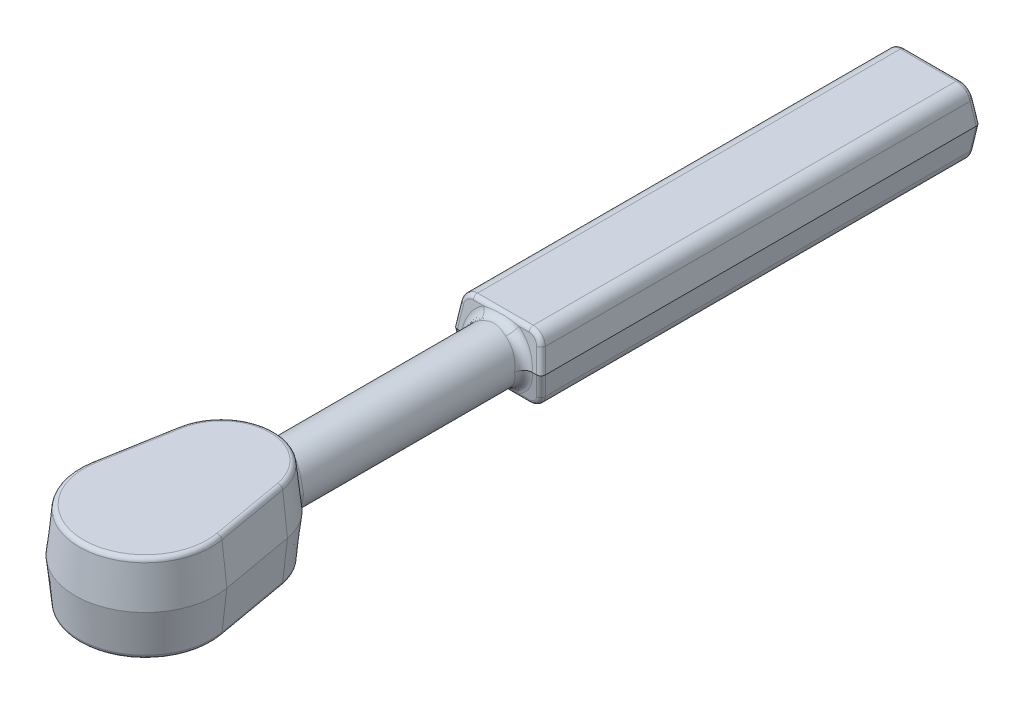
SolidWorks part; units mm, degrees
ref_plane "Front Plane" through (0, 0, 0) normal (0, 0, 1) x (1, 0, 0)
ref_plane "Top Plane" through (0, 0, 0) normal (0, 1, 0) x (1, 0, 0)
ref_plane "Right Plane" through (0, 0, 0) normal (1, 0, 0) x (0, 0, -1)
sketch "Sketch1" plane through (0, 0, 0) normal (0, 1, 0) x (1, 0, 0)
  line L0 (0, 0) -> (0, 180) construction
  line L1 (-10, 180) -> (10, 180)
  line L2 (10, 180) -> (10, 80)
  line L3 (-10, 180) -> (-10, 80)
  line L4 (10, 80) -> (0, 80)
  line L5 (-10, 80) -> (0, 80)
  dimension "D1" = 100
  dimension "D2" = 20
  dimension "D3" = 180
extrude "Handle" add sketch "Sketch1" along normal mid plane 15 draft 8
sketch "Sketch2" plane through (0, 0, 0) normal (0, 0, 1) x (1, 0, 0)
  circle A0 centre (0, 0) radius 6
  dimension "D1" = 12
extrude "Transition" add sketch "Sketch2" against normal up to next
sketch "Sketch3" plane through (0, 0, 0) normal (0, 1, 0) x (1, 0, 0)
  line L0 (0, 0) -> (0, 17.2763) construction
  line L1 (-12.8025, 19.5337) -> (-15.7569, 2.7784)
  line L2 (12.8025, 19.5337) -> (15.7569, 2.7784)
  arc A0 (15.7569, 2.7784) -> (-15.7569, 2.7784) centre (0, 0) cw
  arc A1 (-12.8025, 19.5337) -> (12.8025, 19.5337) centre (0, 17.2763) cw
  dimension "D1" = 13
  dimension "D2" = 16
  dimension "D4" = 20
extrude "Head" add sketch "Sketch3" along normal mid plane 20 draft 6
sketch "Sketch4" plane through (0, 10, 0) normal (0, 1, 0) x (-1, 0, 0)
  line L4 (9.7978, -19.0039) -> (12.7522, -2.2486)
  line L5 (-12.7522, -2.2486) -> (-9.7978, -19.0039)
  line L6 (9.7978, -19.0039) -> (12.7522, -2.2486)
  line L7 (-12.7522, -2.2486) -> (-9.7978, -19.0039)
  arc A4 (-9.7978, -19.0039) -> (9.7978, -19.0039) centre (0, -17.2763) ccw
  arc A5 (12.7522, -2.2486) -> (-12.7522, -2.2486) centre (0, 0) ccw
  arc A6 (-9.7978, -19.0039) -> (9.7978, -19.0039) centre (0, -17.2763) ccw
  arc A7 (12.7522, -2.2486) -> (-12.7522, -2.2486) centre (0, 0) ccw
  dimension "D1" = 2
extrude "Recess" [suppressed] cut sketch "Sketch4" against normal blind 2
sketch "Sketch5" [suppressed] plane through (0, 8, 0) normal (0, 1, 0) x (-1, 0, 0)
  arc A0 (-5.8786, -10.4615) -> (5.8786, -10.4615) centre (0, -17.2763) ccw
  arc A1 (5.8786, -10.4615) -> (-5.8786, -10.4615) centre (0, 0) ccw
  arc A2 (12.7522, -2.2486) -> (-12.7522, -2.2486) centre (0, 0) ccw construction
  dimension "D1" = 18
  dimension "D2" = 24
extrude "Pocket" [suppressed] cut sketch "Sketch5" against normal offset from surface (13 mm away) 5
sketch "Sketch6" [suppressed] plane through (0, -5, 0) normal (0, 1, 0) x (-1, 0, 0)
  circle A0 centre (0, -17.2763) radius 4.5
  dimension "D1" = 9
extrude "Wheel Hole" [suppressed] cut sketch "Sketch6" against normal through all
sketch "Sketch7" [suppressed] plane through (-4.6514, -5, 19.111) normal (0, 1, 0) x (-1, 0, 0)
  circle A0 centre (-4.6514, -19.111) radius 6
  arc A1 (1.2272, -29.5724) -> (-10.53, -29.5724) centre (-4.6514, -19.111) ccw construction
  dimension "D1" = 6
extrude "Ratchet Hole" [suppressed] cut sketch "Sketch7" against normal through all
fillet "Handle Fillets" radius 3 4 edges at (8.9459, 7.5, -130) (-8.9459, -7.5, -130) (8.9459, -7.5, -130) (-8.9459, 7.5, -130)
fillet "H End Fillets" radius 1 28 edges at (0, 10, -29.2253) (-13.2446, 10, -10.9735) (0, 10, 14.949) (13.2446, 10, -10.9735) (0, -10, -29.2253) (13.2446, -10, -10.9735) (0, -10, 14.949) (-13.2446, -10, -10.9735) (-9.6544, -2.4588, -179.6544) (-9.6544, -2.4588, -80.3456) (0, -7.5, -81.0541) (9.6544, -2.4588, -80.3456) (8.3063, -6.7641, -80.9506) (-8.3063, -6.7641, -80.9506) (0, -7.5, -178.9459) (9.6544, -2.4588, -179.6544) (8.3063, -6.7641, -179.0494) (-8.3063, -6.7641, -179.0494) (0, 7.5, -81.0541) (0, 7.5, -178.9459) (-9.6544, 2.4588, -179.6544) (9.6544, 2.4588, -179.6544) (-8.3063, 6.7641, -179.0494) (8.3063, 6.7641, -179.0494) (9.6544, 2.4588, -80.3456) (-9.6544, 2.4588, -80.3456) (-8.3063, 6.7641, -80.9506) (8.3063, 6.7641, -80.9506)
fillet "T-H Fillets" radius 2 4 edges at (0, -6, -80.8432) (0, 6, -80.8432) (0.2191, -5.996, -29.6442) (0.2191, 5.996, -29.6442)
